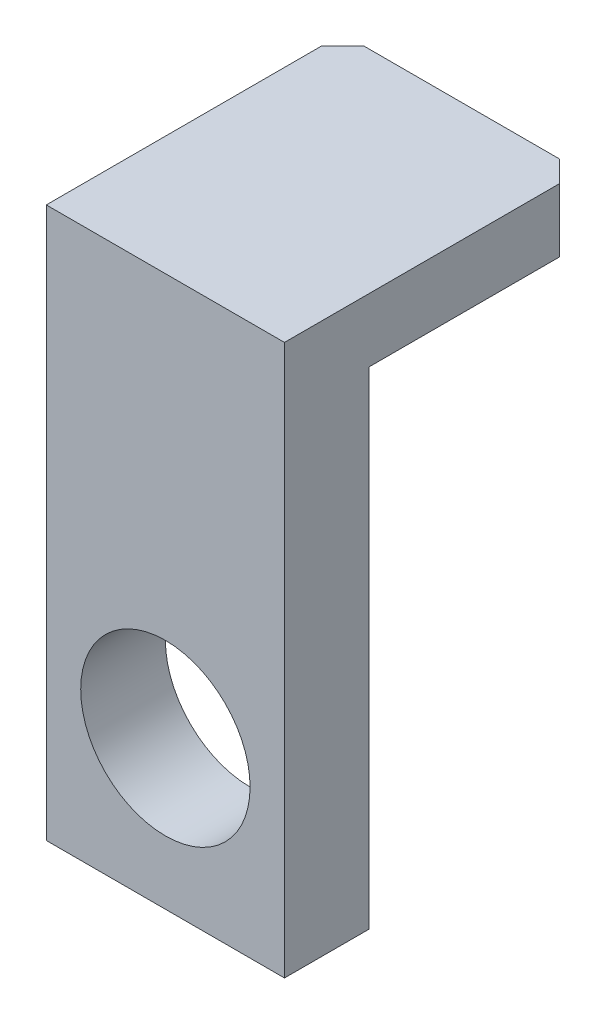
SolidWorks part; units mm, degrees
ref_plane "Plan de face" through (0, 0, 0) normal (0, 0, 1) x (1, 0, 0)
ref_plane "Plan de dessus" through (0, 0, 0) normal (0, 1, 0) x (1, 0, 0)
ref_plane "Plan de droite" through (0, 0, 0) normal (1, 0, 0) x (0, 0, -1)
sketch "Esquisse1" plane through (0, 0, 0) normal (0, 0, 1) x (1, 0, 0)
  line L0 (5.625, 26) -> (5.625, 0) construction
  line L1 (0, 0) -> (11.25, 0)
  line L2 (0, 0) -> (0, 26)
  line L3 (0, 26) -> (11.25, 26)
  line L4 (11.25, 0) -> (11.25, 26)
  circle A0 centre (5.625, 7) radius 4
  dimension "D3" = 8
  dimension "D1" = 26
  dimension "D2" = 11.25
  dimension "D4" = 7
extrude "Extrusion1" add sketch "Esquisse1" along normal blind 4
sketch "Esquisse2" plane through (0, 0, 0) normal (0, 0, -1) x (-1, 0, 0)
  line L0 (0, 26) -> (0, 0) construction
  line L1 (-11.25, 26) -> (0, 26)
  line L2 (-11.25, 26) -> (-11.25, 23)
  line L3 (-11.25, 23) -> (0, 23)
  line L4 (0, 26) -> (0, 23)
  dimension "D1" = 3
extrude "Extrusion2" add sketch "Esquisse2" along normal blind 10
chamfer "Chanfrein1" distance 1 angle 45 2 edges at (0, 24.5, -10) (11.25, 24.5, -10)
